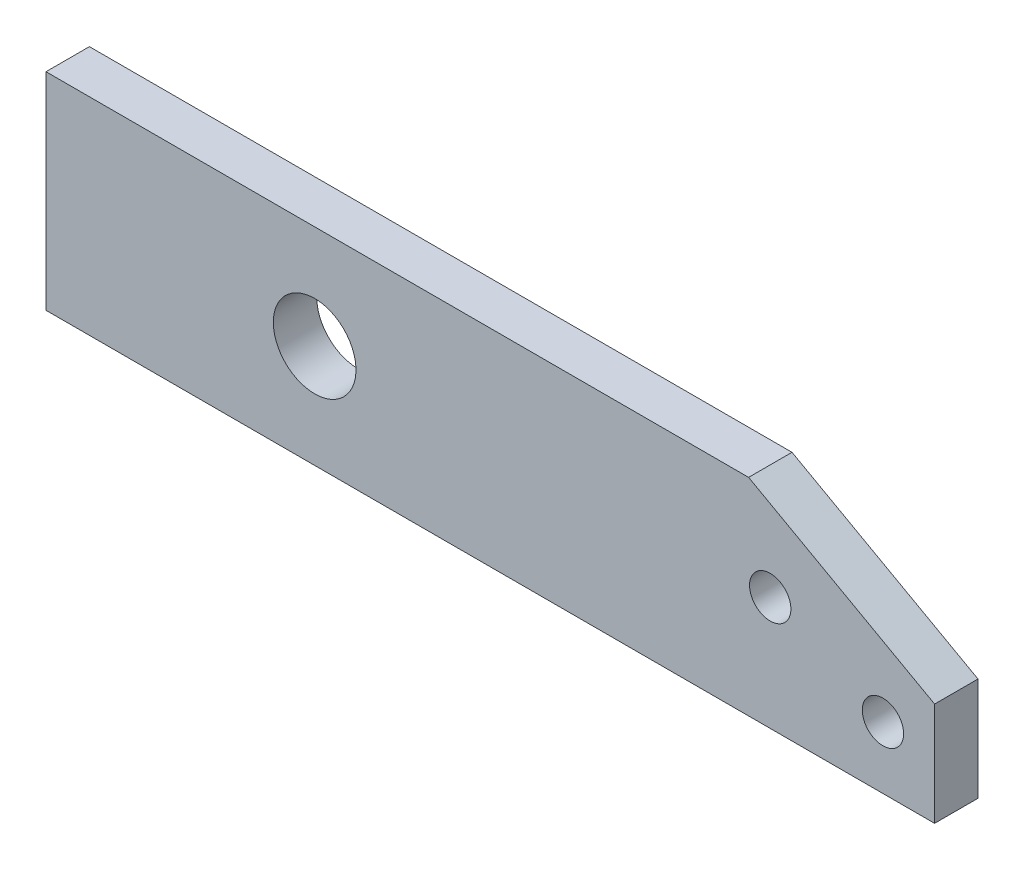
SolidWorks part; units mm, degrees
ref_plane "Plan de face" through (0, 0, 0) normal (0, 0, 1) x (1, 0, 0)
ref_plane "Plan de dessus" through (0, 0, 0) normal (0, 1, 0) x (1, 0, 0)
ref_plane "Plan de droite" through (0, 0, 0) normal (1, 0, 0) x (0, 0, -1)
sketch "Esquisse1" plane through (0, 0, 0) normal (0, 0, 1) x (1, 0, 0)
  line L0 (340, 0) -> (430, -50)
  line L1 (0, 0) -> (340, 0)
  line L2 (0, 0) -> (0, -100)
  line L3 (0, -100) -> (430, -100)
  line L4 (430, -50) -> (430, -100)
  circle A0 centre (405, -70) radius 10
  circle A1 centre (350.4564, -45) radius 10
  circle A2 centre (130, -50) radius 20
  dimension "D5" = 20
  dimension "D8" = 20
  dimension "D11" = 40
  dimension "D1" = 430
  dimension "D2" = 100
  dimension "D3" = 50
  dimension "D4" = 90
  dimension "D6" = 25
  dimension "D7" = 30
  dimension "D9" = 55
  dimension "D10" = 60
  dimension "D12" = 50
  dimension "D13" = 130
extrude "Extrusion1" add sketch "Esquisse1" along normal blind 21
